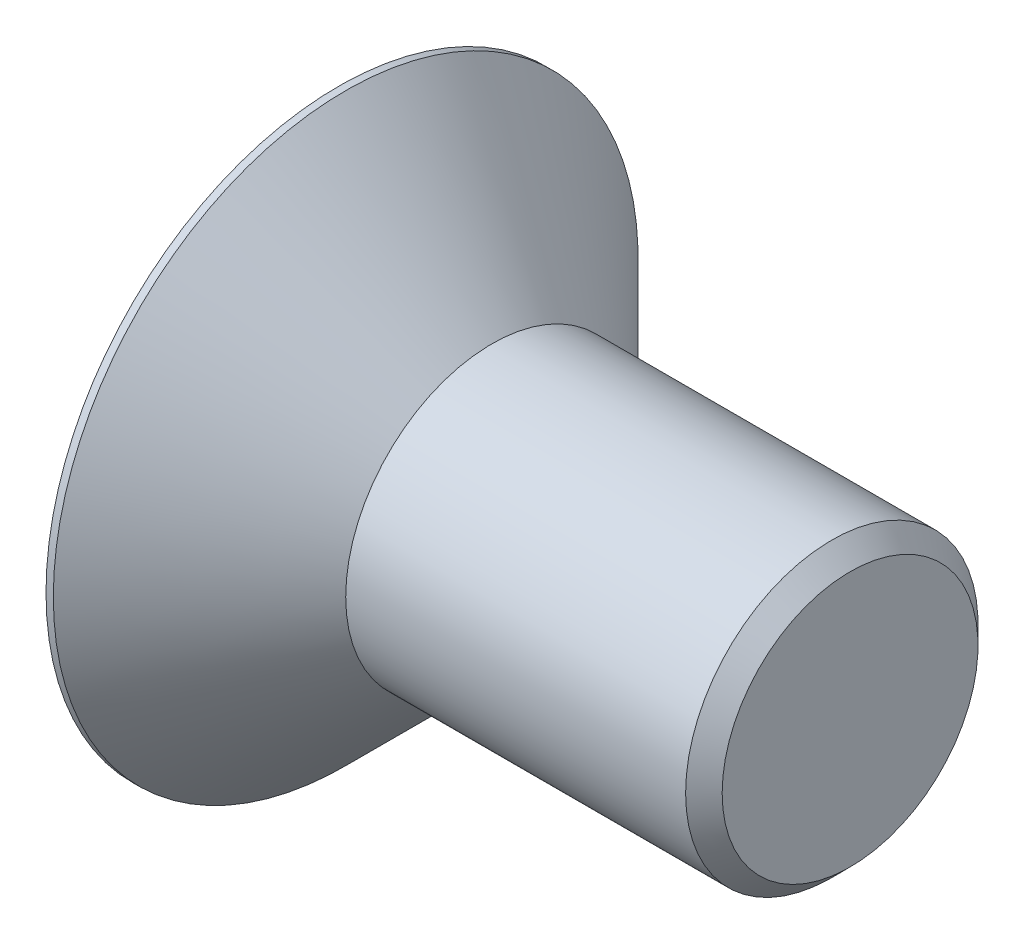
SolidWorks part; units mm, degrees
ref_plane "Ebene vorne" through (0, 0, 0) normal (0, 0, 1) x (1, 0, 0)
ref_plane "Ebene oben" through (0, 0, 0) normal (0, 1, 0) x (1, 0, 0)
ref_plane "Ebene rechts" through (0, 0, 0) normal (1, 0, 0) x (0, 0, -1)
sketch "Skizze1" plane through (0, 0, 0) normal (0, 0, 1) x (1, 0, 0)
  line L0 (0, 0) -> (2554.3716, 0) construction
  line L1 (0, -1000) -> (0, 8) construction
  line L2 (0, 0) -> (0, 8)
  line L3 (0.2, 8) -> (4.2, 4)
  line L4 (4.2, 4) -> (14, 4)
  line L5 (14, 4) -> (14, 0)
  line L6 (14, 0) -> (0, 0)
  line L7 (0, 8) -> (0.2, 8)
  point P7 (0, 4)
  dimension "D1" = 8
  dimension "D2" = 4.2
  dimension "D3" = 16
  dimension "D4" = 14
  dimension "D5" = 45
revolve "Rotation1" add sketch "Skizze1" angle 360 about L0
chamfer "Fase1" distance 0.5 angle 45 1 edges at (14, 0, 4)
sketch "Skizze2" plane through (0, 0, 0) normal (-1, 0, 0) x (0, 0, 1)
  line L1 (2.3377, 1.6936) -> (-0.2979, 2.8713)
  line L2 (-0.2979, 2.8713) -> (-2.6356, 1.1777)
  line L3 (-2.6356, 1.1777) -> (-2.3377, -1.6936)
  line L4 (-2.3377, -1.6936) -> (0.2979, -2.8713)
  line L5 (0.2979, -2.8713) -> (2.6356, -1.1777)
  line L6 (2.6356, -1.1777) -> (2.3377, 1.6936)
  circle A0 centre (0, 0) radius 2.5 construction
  dimension "D1" = 5
extrude "Schnitt-Linear austragen1" cut sketch "Skizze2" against normal blind 2.5
